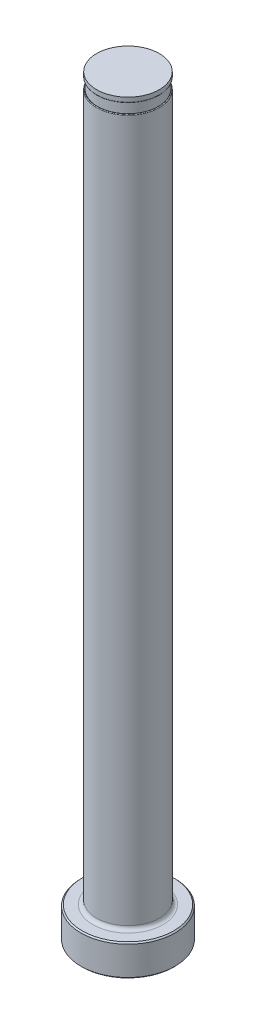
SolidWorks part; units mm, degrees
ref_plane "Front Plane" through (0, 0, 0) normal (0, 0, 1) x (1, 0, 0)
ref_plane "Top Plane" through (0, 0, 0) normal (0, 1, 0) x (1, 0, 0)
ref_plane "Right Plane" through (0, 0, 0) normal (1, 0, 0) x (0, 0, -1)
other "Configuration Table"
sketch "Sketch1" plane through (0, 0, 0) normal (0, 0, 1) x (1, 0, 0)
  line L0 (0, 259.9588) -> (0, -15.1925) construction
  line L1 (0, 0) -> (-9.525, 0)
  line L2 (-9.525, 0) -> (-9.525, 6.35)
  line L3 (-9.525, 6.35) -> (-6.35, 6.35)
  line L4 (-6.35, 6.35) -> (-6.35, 152.4)
  line L5 (-6.35, 152.4) -> (0, 152.4)
  line L6 (0, 152.4) -> (0, 0)
  dimension "L" = 152.4
  dimension "H" = 19.05
  dimension "T" = 6.35
  dimension "D" = 12.7
revolve "Revolve1" add sketch "Sketch1" angle 360 about L0
chamfer "Chamfer1" distance 0.254 angle 45 2 edges at (0, 6.35, 9.525) (0, 0, 9.525)
fillet "Fillet1" radius 0.762 1 edges at (0, 6.35, 6.35)
sketch "Sketch2" plane through (0, 0, 0) normal (0, 0, 1) x (1, 0, 0)
  line L0 (-6.35, 152.4) -> (-6.35, 7.112) construction
  line L1 (-6.35, 151.384) -> (-6.1468, 151.384)
  line L2 (-6.35, 151.384) -> (-6.35, 149.352)
  line L3 (-6.35, 149.352) -> (-6.1468, 149.352)
  line L4 (-6.1468, 151.384) -> (-6.1468, 149.352)
  line L5 (6.35, 152.4) -> (-6.35, 152.4) construction
  line L6 (0, 153.4483) -> (0, 147.3282) construction
  dimension "D1" = 2.032
  dimension "N" = 1.016
  dimension "FD" = 0.2032
  dimension "D3" = 12.2936
revolve "Vent Relief" cut sketch "Sketch2" angle 360 about L6
sketch "Sketch3" plane through (0, 0, 0) normal (0, 0, 1) x (1, 0, 0)
  line L0 (-6.1468, 150.368) -> (-6.1468, 86.868)
  line L1 (-6.1468, 151.384) -> (-6.1468, 149.352) construction
  line L2 (-6.35, 149.352) -> (-6.35, 7.112) construction
  line L3 (-6.35, 85.7504) -> (-6.35, 150.368)
  line L4 (-6.35, 150.368) -> (-6.1468, 150.368)
  arc A0 (-6.1468, 86.868) -> (-6.35, 85.7504) centre (-9.3218, 86.868) cw
  dimension "D1" = 3.175
  dimension "D2" = 63.5
extrude "D-Slot" cut sketch "Sketch3" against normal through all both and the other way through all
sketch "Sketch5" plane through (0, 0, 0) normal (0, 0, 1) x (1, 0, 0)
  line L0 (-6.35, 151.384) -> (6.35, 151.384) construction
  line L1 (-6.35, 152.4) -> (-6.3449, 152.4)
  line L2 (-6.35, 152.4) -> (-6.35, 151.384)
  line L3 (-6.35, 151.384) -> (-6.3449, 151.384)
  line L4 (-6.3449, 152.4) -> (-6.3449, 151.384)
  line L5 (0, 152.6877) -> (0, 150.5771) construction
  dimension "VP" = 0.0051
revolve "Vent Diameter" cut sketch "Sketch5" angle 360 about L5
fillet "Fillet2" radius 0.127 2 edges at (6.35, 149.352, 0) (0, 151.384, 6.3449)
sketch "Pocket Sketch" plane through (0, 0, 0) normal (0, 0, 1) x (1, 0, 0)
  line L0 (-9.9219, 0) -> (-9.9219, 6.3754)
  line L1 (-9.9219, 6.3754) -> (-7.3104, 6.3754)
  line L2 (-6.5484, 7.1374) -> (-6.5484, 22.225)
  line L3 (-6.5484, 22.225) -> (0, 22.225)
  line L4 (0, 22.225) -> (0, 0)
  line L5 (0, 0) -> (-9.9219, 0)
  line L6 (0, 12.6104) -> (0, -2.4989) construction
  line L7 (-9.525, 6.096) -> (-9.525, 0.254) construction
  line L8 (9.271, 6.35) -> (-9.271, 6.35) construction
  line L9 (-6.35, 85.7504) -> (-6.35, 7.112) construction
  line L10 (-7.3104, 6.3754) -> (-6.5484, 7.1374)
  point P3 (-6.5484, 6.3754)
  dimension "D1" = 19.8437
  dimension "D2" = 0.3969
  dimension "D3" = 0.0254
  dimension "D4" = 0.1984
  dimension "D5" = 13.0969
  dimension "D6" = 22.225
